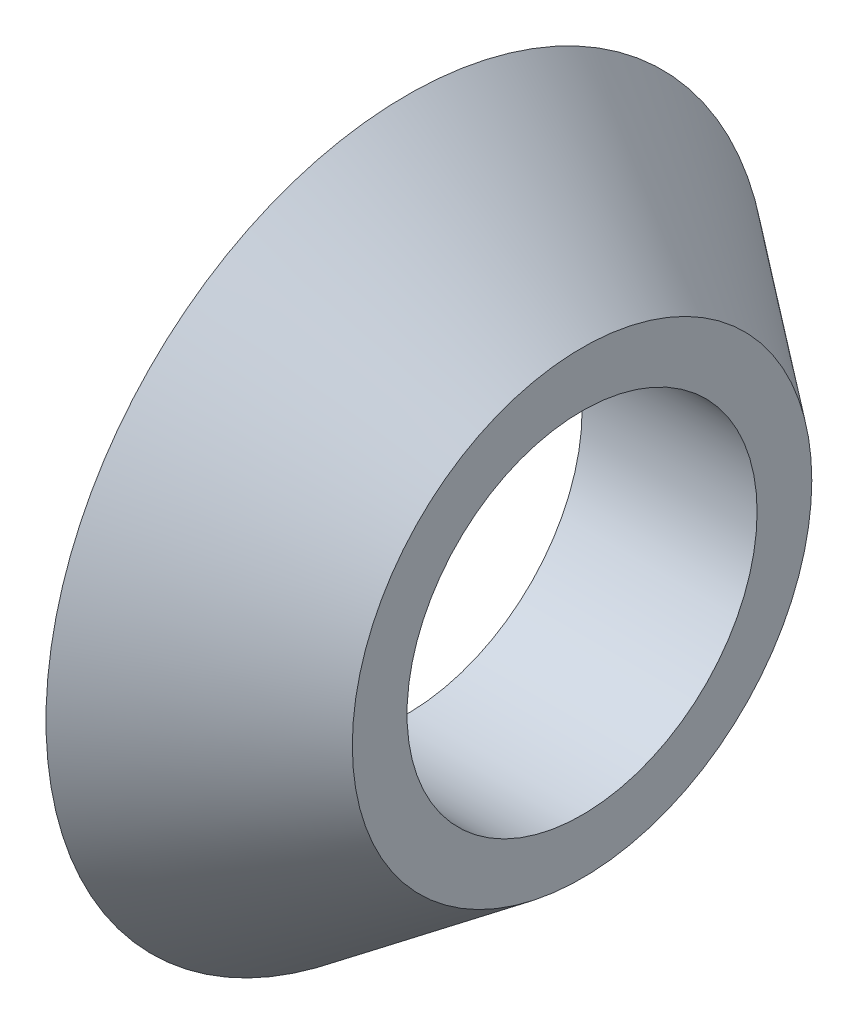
SolidWorks part; units mm, degrees
ref_plane "Face" through (0, 0, 0) normal (0, 0, 1) x (1, 0, 0)
ref_plane "Dessus" through (0, 0, 0) normal (0, 1, 0) x (1, 0, 0)
ref_plane "Droite" through (0, 0, 0) normal (1, 0, 0) x (0, 0, -1)
sketch "Esquisse1" plane through (0, 0, 0) normal (0, 0, 1) x (1, 0, 0)
  line L0 (17.6092, 0) -> (-41.0882, 0) construction
  line L1 (0, 0) -> (-18.2011, 13.6509) construction
  line L2 (0, 8.6673) -> (0, -14.7475) construction
  line L3 (-5.5, 4.125) -> (-3.5, 2.625)
  line L4 (-3.5, 2.625) -> (-3.5, 2)
  line L5 (-3.5, 2) -> (-5.5, 2)
  line L6 (-5.5, 2) -> (-5.5, 4.125)
  point P5 (-7.5, 5.625)
  dimension "D3" = 7
  dimension "D1" = 11.25
  dimension "D2" = 15
  dimension "D4" = 5.5
  dimension "D5" = 4
revolve "Base-Révolution" add sketch "Esquisse1" angle 360 about L0
